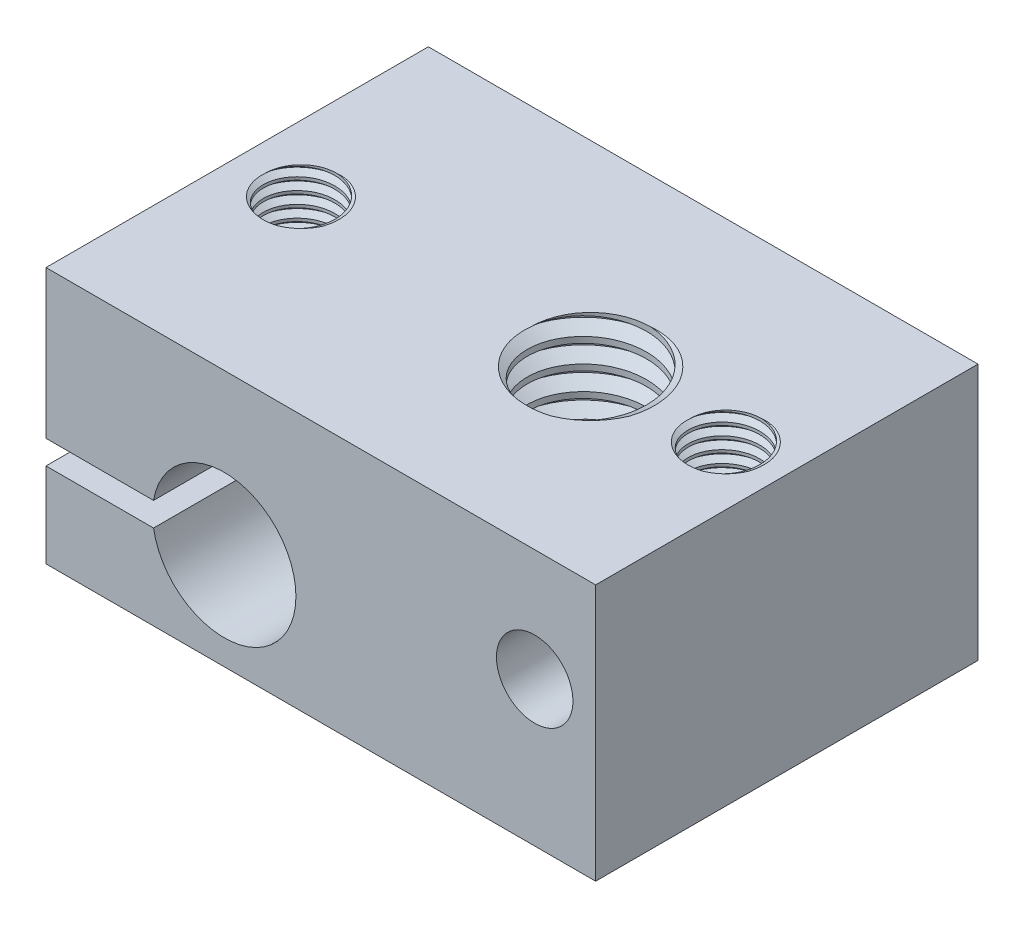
SolidWorks part; units mm, degrees
ref_plane "Front Plane" through (0, 0, 0) normal (0, 0, 1) x (1, 0, 0)
ref_plane "Top Plane" through (0, 0, 0) normal (0, 1, 0) x (1, 0, 0)
ref_plane "Right Plane" through (0, 0, 0) normal (1, 0, 0) x (0, 0, -1)
sketch "Sketch1" plane through (0, 0, 0) normal (0, 1, 0) x (1, 0, 0)
  line L0 (0, 8) -> (23, 8) construction
  line L1 (0, 0) -> (23, 0)
  line L2 (0, 0) -> (0, 16)
  line L3 (0, 16) -> (23, 16)
  line L4 (23, 0) -> (23, 16)
  circle A0 centre (14.79, 8) radius 2.5
  circle A1 centre (2.67, 8) radius 1.5
  dimension "D3" = 5
  dimension "D4" = 3
  dimension "D5" = 2.67
  dimension "D6" = 14.79
  dimension "D1" = 23
  dimension "D2" = 16
extrude "Boss-Extrude1" add sketch "Sketch1" along normal blind 10.74
sketch "Sketch2" plane through (0, 0, -16) normal (0, 0, -1) x (-1, 0, 0)
  line L0 (-23, 0) -> (0, 0) construction
  line L2 (-7.458, 4.05) -> (7.458, 4.05) construction
  line L3 (0, 10.74) -> (0, 0) construction
  line L4 (4.5, 4.55) -> (-4.5, 4.55)
  line L5 (4.5, 4.55) -> (4.5, 3.55)
  line L6 (4.5, 3.55) -> (-4.5, 3.55)
  line L7 (-4.5, 4.55) -> (-4.5, 3.55)
  line L8 (4.5, 4.55) -> (-4.5, 3.55) construction
  line L9 (4.5, 3.55) -> (-4.5, 4.55) construction
  circle A0 centre (-7.458, 4.05) radius 3
  circle A1 centre (-20.45, 6.05) radius 1.6
  point P4 (0, 4.05)
  dimension "D1" = 4.05
  dimension "D2" = 1
  dimension "D4" = 6
  dimension "D5" = 3.2
  dimension "D6" = 20.45
  dimension "D7" = 6.05
  dimension "D3" = 4.5
extrude "Cut-Extrude1" cut sketch "Sketch2" against normal through all contours A0 L6 L4 M9 | L7 A0 | A1
sketch "Sketch3" plane through (0, 10.74, 0) normal (0, 1, 0) x (1, 0, 0)
  line L1 (0, 16) -> (0, 0) construction
  line L2 (0, 8) -> (23, 8) construction
  line L3 (23, 0) -> (23, 16) construction
  circle A0 centre (20.45, 8) radius 1.5
  dimension "D1" = 3
  dimension "D2" = 20.45
extrude "Cut-Extrude2" cut sketch "Sketch3" against normal up to next
thread "Thread1" pitch 0.5 start angle 0, offset 1, length 5, pitch 0.5, diameter 3
ref_plane "Plane2" through (18.95, 11.74, -8) normal (0, 0, 1) x (-1, 0, 0)
sketch "Thread Profile2" plane through (18.95, 11.74, -8) normal (0, 0, 1) x (-1, 0, 0)
  line L0 (0, 0) -> (0, 0.5) construction
  line L1 (0, 0) -> (0.2706, 0.1562)
  line L2 (0.2706, 0.1562) -> (0.2706, 0.2187)
  line L3 (0.2706, 0.2187) -> (0, 0.375)
  line L4 (0.2706, 0.1875) -> (0, 0.1875) construction
  line L11 (0, 0) -> (0, 0.375)
  point P2 (0, 0)
  dimension "Pitch" = 0.5
  dimension "Profile_Angle" = 60
  dimension "Profile_Land" = 0.0625
  dimension "Profile_Height" = 0.2706
thread "Thread2" pitch 0.5 start angle 0, offset 1, length 0, pitch 0.5, diameter 3
ref_plane "Plane3" through (1.17, 11.74, -8) normal (0, 0, 1) x (-1, 0, 0)
sketch "Thread Profile3" plane through (1.17, 11.74, -8) normal (0, 0, 1) x (-1, 0, 0)
  line L0 (0, 0) -> (0, 0.5) construction
  line L1 (0, 0) -> (0.2706, 0.1562)
  line L2 (0.2706, 0.1562) -> (0.2706, 0.2187)
  line L3 (0.2706, 0.2187) -> (0, 0.375)
  line L4 (0.2706, 0.1875) -> (0, 0.1875) construction
  line L11 (0, 0) -> (0, 0.375)
  point P2 (0, 0)
  dimension "Pitch" = 0.5
  dimension "Profile_Angle" = 60
  dimension "Profile_Land" = 0.0625
  dimension "Profile_Height" = 0.2706
thread "Thread3" pitch 1 start angle 0, offset 1, length 0, pitch 1, diameter 5
ref_plane "Plane4" through (12.29, 11.74, -8) normal (0, 0, 1) x (-1, 0, 0)
sketch "Thread Profile4" plane through (12.29, 11.74, -8) normal (0, 0, 1) x (-1, 0, 0)
  line L0 (0, 0) -> (0, 1) construction
  line L1 (0, 0) -> (0.5413, 0.3125)
  line L2 (0.5413, 0.3125) -> (0.5413, 0.4375)
  line L3 (0.5413, 0.4375) -> (0, 0.75)
  line L4 (0.5413, 0.375) -> (0, 0.375) construction
  line L11 (0, 0) -> (0, 0.75)
  point P2 (0, 0)
  dimension "Pitch" = 1
  dimension "Profile_Angle" = 60
  dimension "Profile_Land" = 0.125
  dimension "Profile_Height" = 0.5413
